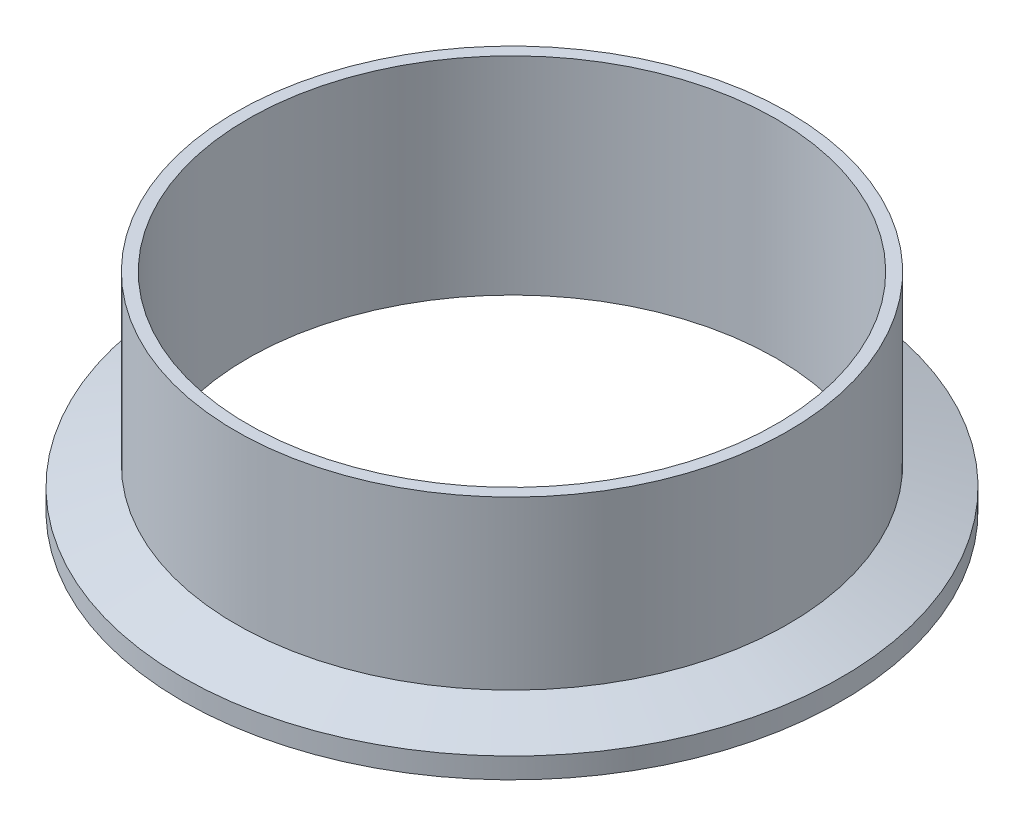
SolidWorks part; units mm, degrees
ref_plane "Front Plane" through (0, 0, 0) normal (0, 0, 1) x (1, 0, 0)
ref_plane "Top Plane" through (0, 0, 0) normal (0, 1, 0) x (1, 0, 0)
ref_plane "Right Plane" through (0, 0, 0) normal (1, 0, 0) x (0, 0, -1)
sketch "Sketch1" plane through (0, 0, 0) normal (0, 0, 1) x (1, 0, 0)
  line L0 (0, 0) -> (0, 28.575) construction
  line L1 (0, 28.575) -> (-38.1, 28.575)
  line L2 (-38.1, 28.575) -> (-38.1, 5.5212)
  line L3 (-38.1, 5.5212) -> (-45.4533, 2.8448)
  line L4 (-45.4533, 2.8448) -> (-45.4533, 0)
  line L5 (-45.4533, 0) -> (-43.4867, 0)
  line L6 (-39.8507, 0) -> (0, 0)
  line L7 (0, 0) -> (0, 28.575)
  line L8 (0, 28.575) -> (-36.449, 28.575)
  line L9 (-36.449, 28.575) -> (-36.449, 0)
  line L10 (-36.449, 0) -> (0, 0)
  line L11 (0, 0) -> (-0.1846, 0.0129)
  arc A0 (-42.7642, 0.4745) -> (-40.5732, 0.4745) centre (-41.6687, 0) cw
  arc A1 (-39.8507, 0) -> (-40.5732, 0.4745) centre (-39.8507, 0.7874) cw
  arc A2 (-42.7642, 0.4745) -> (-43.4867, 0) centre (-43.4867, 0.7874) cw
  point P12 (-40.4749, 0)
  dimension "D6" = 1.1938
  dimension "D7" = 0.7874
  dimension "D1" = 38.1
  dimension "D2" = 2.8448
  dimension "D3" = 45.4533
  dimension "D4" = 70
  dimension "D5" = 41.6687
  dimension "D8" = 1.651
  dimension "D9" = 28.575
revolve "Revolve2" add sketch "Sketch1" angle 360 about L0
